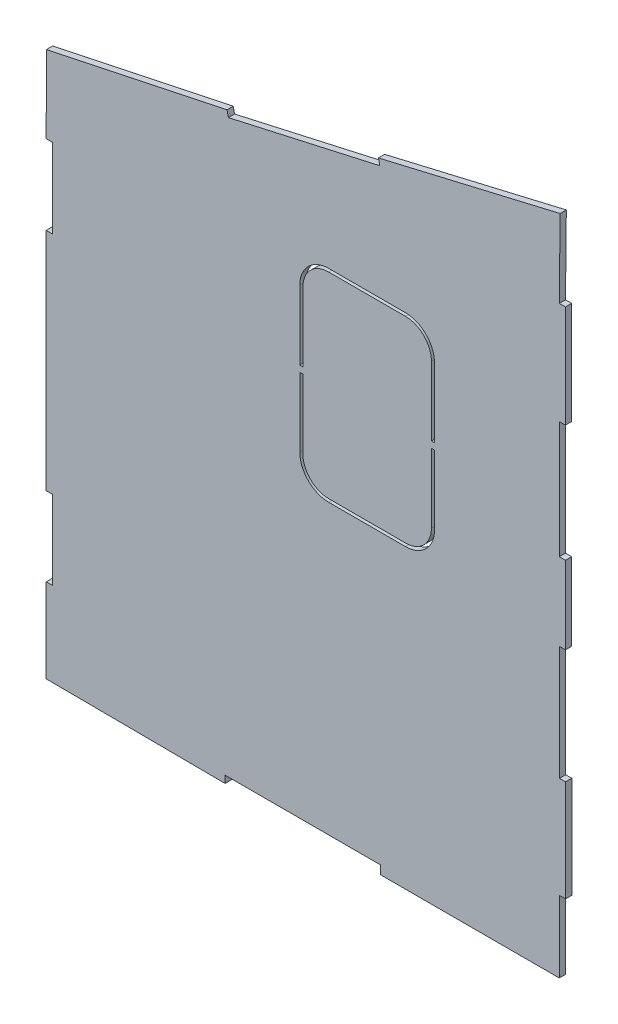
SolidWorks part; units mm, degrees
ref_plane "Front Plane" through (0, 0, 0) normal (0, 0, 1) x (1, 0, 0)
ref_plane "Top Plane" through (0, 0, 0) normal (0, 1, 0) x (1, 0, 0)
ref_plane "Right Plane" through (0, 0, 0) normal (1, 0, 0) x (0, 0, -1)
sketch "Sketch1" plane through (0, 0, 0) normal (0, 0, 1) x (1, 0, 0)
  line L0 (9.0927, 73.7776) -> (9.0432, 54.8058)
  line L1 (9.0432, 54.8058) -> (10.6041, 54.8058)
  line L2 (10.6041, 54.8058) -> (10.5578, 35.3107)
  line L3 (10.5578, 35.3107) -> (9.0432, 35.3107)
  line L4 (9.0432, 35.3107) -> (9.0432, -20.052)
  line L5 (9.0432, -20.052) -> (10.6019, -20.042)
  line L6 (10.6019, -20.042) -> (10.6019, -39.4165)
  line L7 (10.6019, -39.4165) -> (9.0432, -39.4165)
  line L8 (9.0432, -39.4165) -> (9.0432, -60.0538)
  line L9 (9.0432, -60.0538) -> (52.9847, -60.3249)
  line L10 (135.0216, -60.6711) -> (135.0216, -43.0805)
  line L11 (135.0216, -43.0805) -> (136.5737, -43.0805)
  line L12 (136.5737, -43.0805) -> (136.5737, -18.1638)
  line L13 (136.5737, -18.1638) -> (135.0207, -18.2294)
  line L14 (91.0824, -60.6711) -> (135.0216, -60.6711)
  line L15 (135.0207, -18.2294) -> (135.0207, 9.8584)
  line L16 (135.0207, 57.6326) -> (136.5454, 57.6544)
  line L17 (136.5454, 57.6544) -> (136.5454, 82.7889)
  line L18 (136.5454, 82.7889) -> (135.0246, 82.7633)
  line L19 (135.0246, 82.7633) -> (135.2266, 101.9903)
  line L20 (135.2266, 101.9903) -> (90.6178, 91.5052)
  line L21 (53.4461, 83.1459) -> (9.0927, 73.7776)
  line L22 (53.4461, 83.1459) -> (53.7805, 81.659)
  line L23 (90.6178, 91.5052) -> (90.9522, 90.0183)
  line L24 (91.0824, -60.6711) -> (91.0824, -58.5659)
  line L25 (53.7805, 81.659) -> (90.9522, 90.0183)
  line L26 (52.9847, -60.3249) -> (52.9824, -58.5659)
  line L27 (135.0207, 28.9084) -> (135.0207, 57.6326)
  line L28 (91.0824, -58.5659) -> (52.9824, -58.5659)
  line L31 (136.5447, 28.9084) -> (136.5447, 9.8584)
  line L33 (135.0207, 9.8584) -> (136.5447, 9.8584)
  line L34 (135.0207, 28.9084) -> (136.5447, 28.9084)
extrude "Boss-Extrude1" add sketch "Sketch1" along normal blind 1.524
sketch "Sketch2" plane through (0, 0, 1.524) normal (0, 0, 1) x (1, 0, 0)
  line L0 (104.3881, 54.7934) -> (104.3881, 37.8049)
  line L1 (78.416, 61.1434) -> (97.2761, 61.1434)
  line L2 (72.066, 54.7934) -> (72.066, 37.8049)
  line L3 (78.416, 12.9424) -> (97.2761, 12.9424)
  line L4 (103.6261, 54.7934) -> (103.6261, 37.8049)
  line L5 (78.416, 12.1804) -> (97.2761, 12.1804)
  line L6 (71.304, 54.7934) -> (71.304, 37.8049)
  line L7 (78.416, 61.9054) -> (97.2761, 61.9054)
  line L8 (71.304, 36.2809) -> (71.304, 19.2924)
  line L9 (71.304, 36.2809) -> (72.066, 36.2809)
  line L10 (71.304, 37.8049) -> (72.066, 37.8049)
  line L11 (72.066, 36.2809) -> (72.066, 19.2924)
  line L12 (71.304, 54.7934) -> (71.304, 19.2924) construction
  line L13 (103.6261, 37.8049) -> (104.3881, 37.8049)
  line L14 (72.066, 54.7934) -> (72.066, 19.2924) construction
  line L15 (103.6261, 36.2809) -> (104.3881, 36.2809)
  line L16 (104.3881, 36.2809) -> (104.3881, 19.2924)
  line L17 (103.6261, 36.2809) -> (103.6261, 19.2924)
  line L18 (104.3881, 54.7934) -> (104.3881, 19.2924) construction
  line L20 (103.6261, 54.7934) -> (103.6261, 19.2924) construction
  arc A0 (72.066, 19.2924) -> (78.416, 12.9424) centre (78.416, 19.2924) ccw
  arc A1 (78.416, 61.1434) -> (72.066, 54.7934) centre (78.416, 54.7934) ccw
  arc A2 (97.2761, 61.1434) -> (103.6261, 54.7934) centre (97.2761, 54.7934) cw
  arc A3 (97.2761, 12.9424) -> (103.6261, 19.2924) centre (97.2761, 19.2924) ccw
  arc A4 (97.2761, 12.1804) -> (104.3881, 19.2924) centre (97.2761, 19.2924) ccw
  arc A5 (71.304, 19.2924) -> (78.416, 12.1804) centre (78.416, 19.2924) ccw
  arc A6 (78.416, 61.9054) -> (71.304, 54.7934) centre (78.416, 54.7934) ccw
  arc A7 (97.2761, 61.9054) -> (104.3881, 54.7934) centre (97.2761, 54.7934) cw
  dimension "D1" = 6.35
extrude "Cut-Extrude1" cut sketch "Sketch2" against normal blind 1.524
